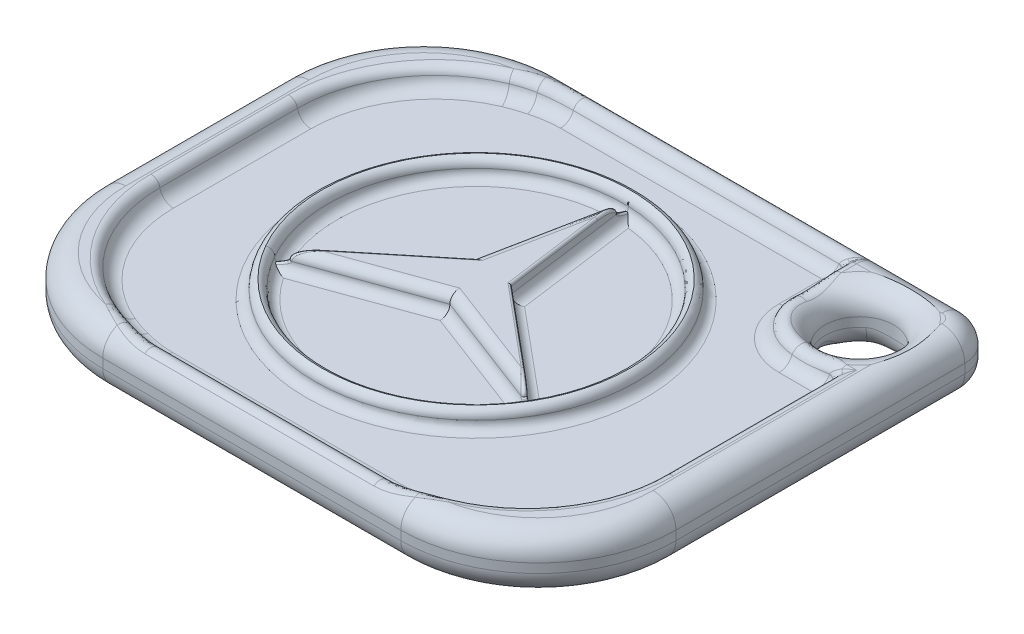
SolidWorks part; units mm, degrees
ref_plane "Ön Düzlem" through (0, 0, 0) normal (0, 0, 1) x (1, 0, 0)
ref_plane "Üst Düzlem" through (0, 0, 0) normal (0, 1, 0) x (1, 0, 0)
ref_plane "Sağ Düzlem" through (0, 0, 0) normal (1, 0, 0) x (0, 0, -1)
sketch "Çizim1" plane through (0, 0, 0) normal (0, 1, 0) x (1, 0, 0)
  line L1 (-41.6667, 37.8333) -> (53.3333, 37.8333)
  line L2 (-71.6667, 7.8333) -> (-71.6667, -32.1667)
  line L3 (-41.6667, -62.1667) -> (23.3333, -62.1667)
  line L4 (53.3333, 37.8333) -> (53.3333, -32.1667)
  arc A0 (23.3333, -62.1667) -> (53.3333, -32.1667) centre (23.3333, -32.1667) ccw
  arc A1 (-71.6667, -32.1667) -> (-41.6667, -62.1667) centre (-41.6667, -32.1667) ccw
  arc A2 (-41.6667, 37.8333) -> (-71.6667, 7.8333) centre (-41.6667, 7.8333) ccw
  circle A3 centre (38.3333, 22.8333) radius 7.5
  point P8 (-71.6667, -62.1667)
  point P11 (-71.6667, 37.8333)
  dimension "D3" = 30
  dimension "D4" = 15
  dimension "D1" = 100
  dimension "D2" = 125
  dimension "D5" = 15
extrude "Yükseklik-Ekstrüzyon1" add sketch "Çizim1" along normal blind 12
sketch "Çizim2" plane through (0, 12, 0) normal (0, 1, 0) x (1, 0, 0)
  line L0 (53.3333, 37.8333) -> (-41.6667, 37.8333) construction
  line L1 (-34.1667, 32.8333) -> (25.8333, 32.8333)
  line L2 (-64.1667, 2.8333) -> (-64.1667, -27.1667)
  line L3 (-34.1667, -57.1667) -> (15.8333, -57.1667)
  line L4 (45.8333, 10.8333) -> (45.8333, -27.1667)
  line L5 (-71.6667, 7.8333) -> (-71.6667, -32.1667) construction
  line L8 (25.8333, 32.8333) -> (25.8333, 20.8333)
  line L9 (35.8333, 10.8333) -> (45.8333, 10.8333)
  arc A0 (15.8333, -57.1667) -> (45.8333, -27.1667) centre (15.8333, -27.1667) ccw
  arc A1 (-64.1667, -27.1667) -> (-34.1667, -57.1667) centre (-34.1667, -27.1667) ccw
  arc A2 (-34.1667, 32.8333) -> (-64.1667, 2.8333) centre (-34.1667, 2.8333) ccw
  arc A3 (25.8333, 20.8333) -> (35.8333, 10.8333) centre (35.8333, 20.8333) ccw
  point P8 (-64.1667, -57.1667)
  point P11 (-64.1667, 32.8333)
  dimension "D3" = 30
  dimension "D8" = 10
  dimension "D1" = 90
  dimension "D2" = 110
  dimension "D4" = 5
  dimension "D5" = 7.5
extrude "Kes-Ekstrüzyon1" cut sketch "Çizim2" against normal blind 4
sketch "Çizim3" plane through (0, 0, 0) normal (0, -1, 0) x (1, 0, 0)
  line L0 (-41.6667, 62.1667) -> (23.3333, 62.1667) construction
  line L1 (-34.1667, 57.1667) -> (15.8333, 57.1667)
  line L2 (-64.1667, 27.1667) -> (-64.1667, -2.8333)
  line L3 (-34.1667, -32.8333) -> (25.8333, -32.8333)
  line L4 (45.8333, 27.1667) -> (45.8333, -10.8333)
  line L6 (-71.6667, -7.8333) -> (-71.6667, 32.1667) construction
  line L11 (25.8333, -32.8333) -> (25.8333, -20.8333)
  line L12 (35.8333, -10.8333) -> (45.8333, -10.8333)
  arc A0 (25.8333, -20.8333) -> (35.8333, -10.8333) centre (35.8333, -20.8333) cw
  arc A1 (-64.1667, -2.8333) -> (-34.1667, -32.8333) centre (-34.1667, -2.8333) ccw
  arc A2 (-34.1667, 57.1667) -> (-64.1667, 27.1667) centre (-34.1667, 27.1667) ccw
  arc A3 (15.8333, 57.1667) -> (45.8333, 27.1667) centre (15.8333, 27.1667) cw
  point P14 (25.8333, -10.8333)
  point P15 (-64.1667, -32.8333)
  point P18 (-64.1667, 57.1667)
  dimension "D7" = 10
  dimension "D1" = 30
  dimension "D2" = 90
  dimension "D3" = 5
  dimension "D4" = 7.5
  dimension "D5" = 22
  dimension "D6" = 20
extrude "Kes-Ekstrüzyon2" cut sketch "Çizim3" against normal blind 4
fillet "Radyus11" radius 5 15 edges at (5.8333, 12, -37.8333) (53.3333, 12, -2.8333) (44.5465, 12, 53.3799) (-9.1667, 12, 62.1667) (-62.8799, 12, 53.3799) (-71.6667, 12, 12.1667) (5.8333, 0, -37.8333) (53.3333, 0, -2.8333) (44.5465, 0, 53.3799) (-9.1667, 0, 62.1667) (-62.8799, 0, 53.3799) (-71.6667, 0, 12.1667) (38.3333, 12, -15.3333) (-62.8799, 12, -29.0465) (-62.8799, 0, -29.0465)
fillet "Radyus12" radius 5 1 edges at (38.3333, 0, -15.3333)
fillet "Radyus13" radius 3 10 edges at (-64.1667, 4, 12.1667) (-55.3799, 4, 48.3799) (-9.1667, 4, 57.1667) (37.0465, 4, 48.3799) (45.8333, 4, 8.1667) (40.8333, 4, -10.8333) (28.7623, 4, -13.7623) (25.8333, 4, -26.8333) (-4.1667, 4, -32.8333) (-55.3799, 4, -24.0465)
fillet "Radyus14" radius 3 2 edges at (25.8333, 0, -27.8333) (38.8331, 0.024, -10.8333)
fillet "Radyus15" radius 3 4 edges at (27.2654, 0.2614, -32.8333) (45.8333, 0.3856, -12.0869) (24.5654, 3.4495, -31.5654) (44.5447, 3.464, -9.5447)
fillet "Radyus18" radius 2 7 edges at (-55.3799, 12, -24.0465) (-64.1667, 12, 12.1667) (-9.1667, 12, 57.1667) (37.0465, 12, 48.3799) (-55.3799, 12, 48.3799) (-4.1667, 12, -32.8333) (45.8333, 12, 8.1667)
fillet "Radyus19" radius 7 3 edges at (51.8689, 1.4645, -36.3689) (51.8689, 10.5355, -36.3689) (53.3333, 6, -37.8333)
fillet "Radyus20" radius 3 10 edges at (40.8333, 8, -10.8333) (25.8333, 8, -26.8333) (-4.1667, 8, -32.8333) (45.8333, 8, 8.1667) (37.0465, 8, 48.3799) (-9.1667, 8, 57.1667) (-55.3799, 8, 48.3799) (-64.1667, 8, 12.1667) (28.7623, 8, -13.7623) (-55.3799, 8, -24.0465)
fillet "Radyus23" radius 2 6 edges at (44.8333, 12, -10.8333) (38.8333, 11.976, -10.8333) (25.8333, 12, -21.8333) (25.8333, 11.6709, -34.6174) (25.8333, 12, -27.8333)
fillet "Radyus24" radius 2 5 edges at (24.5399, 8.5327, -31.8614) (44.8317, 8.6762, -9.7307) (26.2034, 11.1204, -34.163) (46.5684, 11.5492, -11.4674)
sketch "Çizim4" plane through (0, 8, 0) normal (0, 1, 0) x (1, 0, 0)
  line L0 (18.0449, 150.5857) -> (284.7116, 150.5857) construction
  line L1 (-10.9746, -17.1566) -> (-39.0608, -27.3262)
  line L2 (-15.9877, -8.522) -> (-10.1732, 20.8099)
  line L3 (-10.0839, 20.1465) -> (-6.2243, -8.522)
  line L4 (-6.2243, -8.522) -> (16.6506, -27.5855)
  line L5 (16.8613, -27.761) -> (-10.9746, -17.1566)
  line L6 (-38.3904, -26.7798) -> (-15.9877, -8.522)
  line L7 (16.6506, -27.5855) -> (16.8841, -27.7219)
  line L8 (-38.3904, -26.7798) -> (-39.09, -27.2743)
  line L10 (-10.012, 20.8055) -> (-10.0839, 20.1465)
  circle A0 centre (-10.9746, -11.4452) radius 35.0254
  arc A1 (16.8841, -27.7219) -> (-10.012, 20.8055) centre (-10.9746, -11.4452) ccw
  arc A2 (-39.0608, -27.3262) -> (16.8613, -27.761) centre (-10.9746, -11.4452) ccw
  arc A3 (-10.1732, 20.8099) -> (-39.09, -27.2743) centre (-10.9746, -11.4452) ccw
extrude "Yükseklik-Ekstrüzyon3" add sketch "Çizim4" along normal blind 4
fillet "Radyus25" radius 2 11 edges at (-25.0177, 8, 22.2414) (2.9433, 8, 22.4588) (-11.2254, 8, 43.7094) (-38.6249, 8, -5.1831) (-13.0804, 8, -6.1439) (-27.189, 8, 17.6509) (5.2131, 8, 18.0538) (-8.1541, 8, -5.8122) (17.2459, 8, -4.1958) (-10.9746, 12, 46.4706) (-10.9746, 8, 46.4706)
fillet "Radyus26" radius 2 2 edges at (17.2459, 12, -4.1958) (-38.6249, 12, -5.1831)
fillet "Radyus27" radius 2 1 edges at (-11.2254, 12, 43.7094)
fillet "Radyus28" radius 2 3 edges at (-13.0055, 12, -6.5222) (-25.123, 12, 22.2795) (3.0724, 12, 22.508)
fillet "Radyus30" radius 0.5 6 edges at (-9.78, 11.7045, -17.8889) (14.9391, 11.6094, 26.1591) (-36.6772, 11.7406, 25.3837) (-7.7864, 12, -3.0812) (2.9531, 12, 16.1703) (-23.96, 12, 15.0194)
